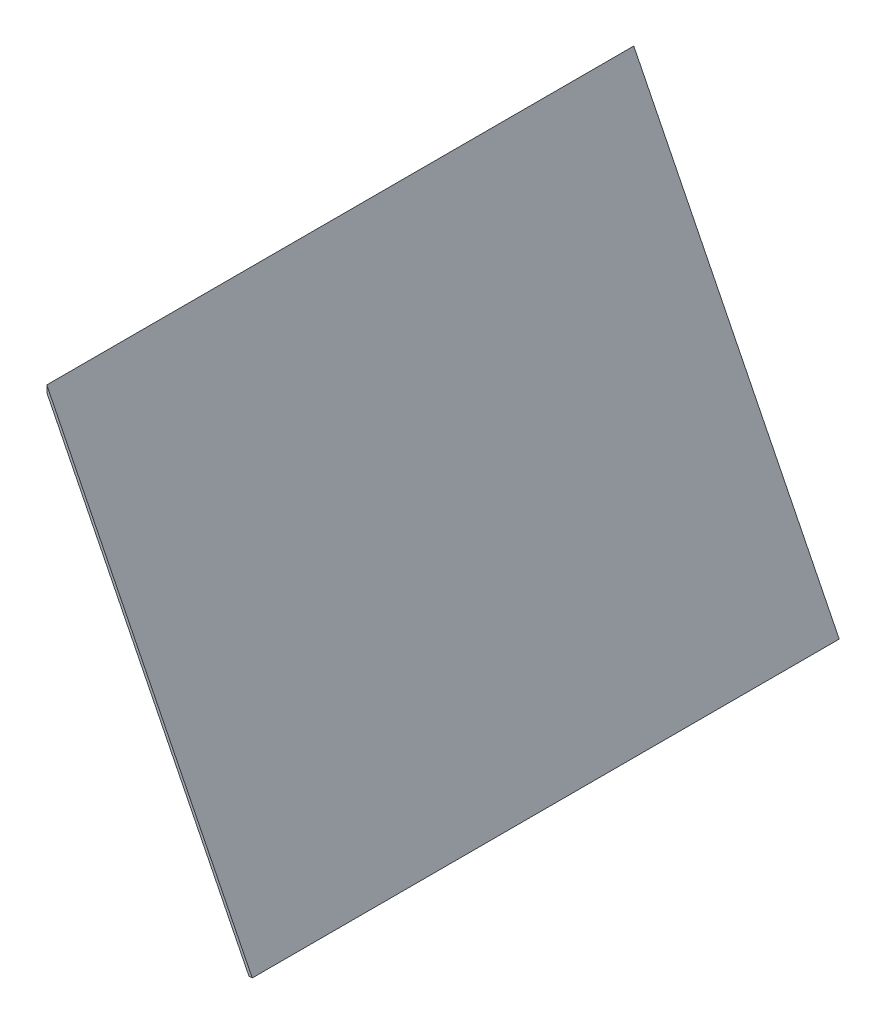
SolidWorks part; units mm, degrees
ref_plane "Front" through (0, 0, 0) normal (0, 0, 1) x (1, 0, 0)
ref_plane "Top" through (0, 0, 0) normal (0, 1, 0) x (1, 0, 0)
ref_plane "Right" through (0, 0, 0) normal (1, 0, 0) x (0, 0, -1)
sketch "草图1" plane through (0, 0, 0) normal (0, 0, 1) x (1, 0, 0)
  line L1 (-7.42, 8.0267) -> (-7.42, -5.9733)
  line L2 (-7.42, -5.9733) -> (-0.42, -5.9733)
  line L3 (-0.42, -5.9733) -> (-7.42, 8.0267)
  dimension "D1" = 14
  dimension "D2" = 7
extrude "凸台-拉伸1" add sketch "草图1" along normal blind 20
sketch "草图3" plane through (0, 0, 0) normal (0, 0, 1) x (1, 0, 0)
  line L0 (-7.42, 7.8016) -> (-0.5325, -5.9733)
  line L6 (-7.42, 8.0267) -> (-7.42, -5.9733) construction
  line L7 (-0.42, -5.9733) -> (-7.42, 8.0267) construction
  line L8 (-7.42, -5.9733) -> (-0.42, -5.9733) construction
  line L9 (-7.42, 7.8016) -> (-7.33, 7.8467)
  line L10 (-7.42, 7.8016) -> (-7.42, -5.9733)
  line L11 (-7.42, -5.9733) -> (-0.5325, -5.9733)
  dimension "D1" = 180
extrude "切除-拉伸1" cut sketch "草图3" along normal blind 20 contours L0 L11 L10
